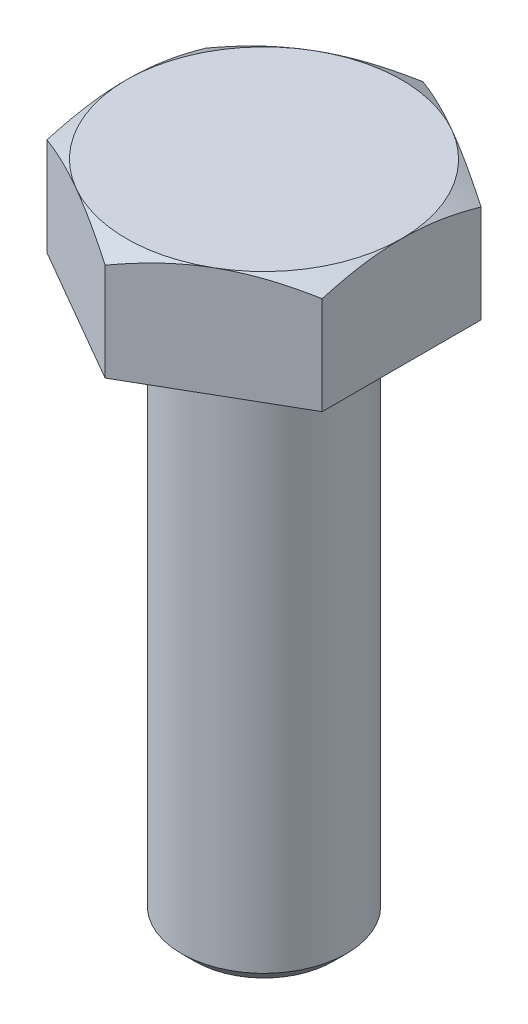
SolidWorks part; units mm, degrees
ref_plane "正面" through (0, 0, 0) normal (0, 0, 1) x (1, 0, 0)
ref_plane "平面" through (0, 0, 0) normal (0, 1, 0) x (1, 0, 0)
ref_plane "右側面" through (0, 0, 0) normal (1, 0, 0) x (0, 0, -1)
sketch "ｽｹｯﾁ1" plane through (0, 0, 0) normal (0, 1, 0) x (1, 0, 0)
  line L0 (0, 0) -> (0, 5.7735) construction
  line L1 (0, 5.7735) -> (-5, 2.8868)
  line L2 (-5, 2.8868) -> (-5, -2.8868)
  line L3 (-5, -2.8868) -> (0, -5.7735)
  line L4 (0, -5.7735) -> (5, -2.8868)
  line L5 (5, -2.8868) -> (5, 2.8868)
  line L6 (5, 2.8868) -> (0, 5.7735)
  circle A0 centre (0, 0) radius 5 construction
  dimension "D1" = 10
extrude "ﾎﾞｽ - 押し出し1" add sketch "ｽｹｯﾁ1" along normal blind 4
sketch "ｽｹｯﾁ2" plane through (0, 0, 0) normal (1, 0, 0) x (0, 0, -1)
  line L0 (0, 0) -> (0, 4) construction
  line L1 (-2.8868, 4) -> (2.8868, 4) construction
  line L2 (5.7735, 4) -> (5, 4)
  line L3 (2.8868, 4) -> (5.7735, 4) construction
  line L4 (5, 4) -> (5.7735, 3.5534)
  line L5 (5.7735, 4) -> (5.7735, 0) construction
  line L6 (5.7735, 3.5534) -> (5.7735, 4)
  dimension "D1" = 10
  dimension "D2" = 30
revolve "ｶｯﾄ - 回転1" cut sketch "ｽｹｯﾁ2" angle 360 about L0
sketch "ｽｹｯﾁ3" plane through (0, 0, 0) normal (0, 1, 0) x (1, 0, 0)
  circle A0 centre (0, 0) radius 3
  dimension "D1" = 6
extrude "ﾎﾞｽ - 押し出し2" add sketch "ｽｹｯﾁ3" against normal blind 20
chamfer "面取り1" distance 0.5 angle 45 1 edges at (0, -20, 3)
